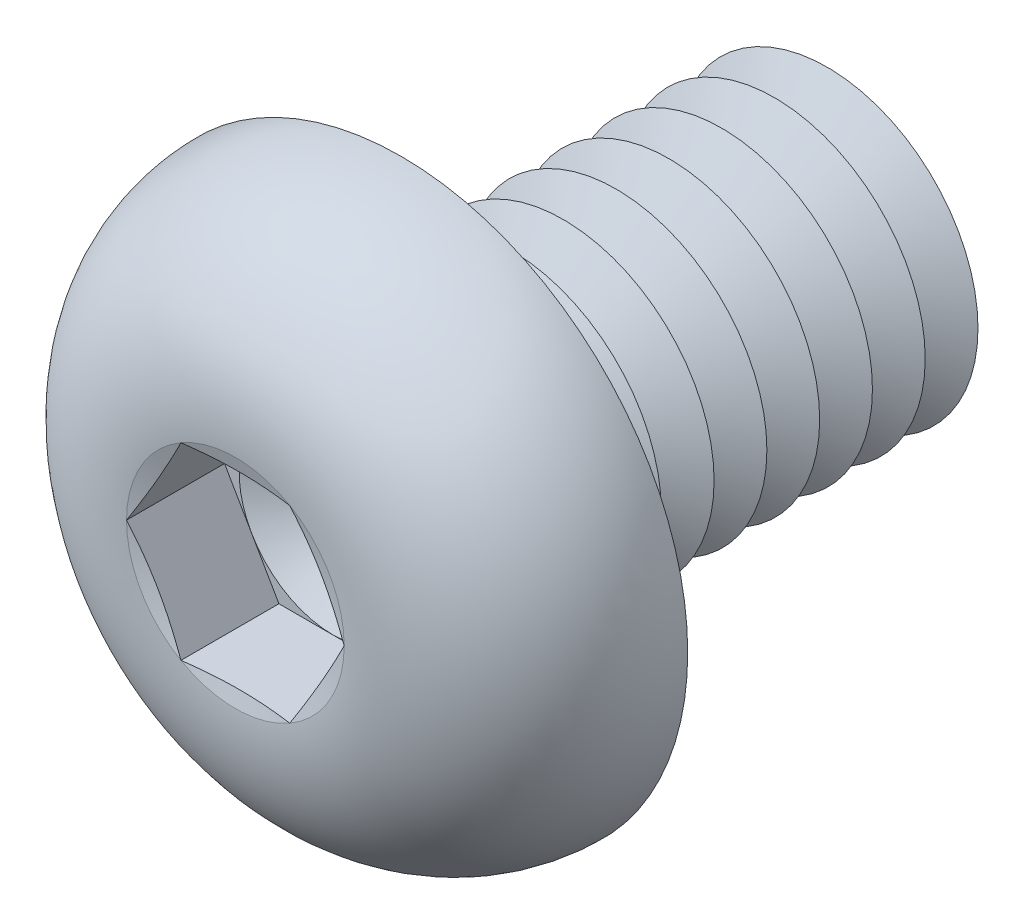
SolidWorks part; units mm, degrees
ref_plane "Front Plane" through (0, 0, 0) normal (0, 0, 1) x (1, 0, 0)
ref_plane "Top Plane" through (0, 0, 0) normal (0, 1, 0) x (1, 0, 0)
ref_plane "Right Plane" through (0, 0, 0) normal (1, 0, 0) x (0, 0, -1)
sketch "Sketch1" plane through (0, 0, 0) normal (1, 0, 0) x (0, 0, -1)
  line L0 (0, 2) -> (0, 3.8)
  line L3 (0, 2) -> (6, 2)
  line L4 (6, 2) -> (6, 0)
  line L5 (6, 0) -> (-2.2, 0) construction
  line L6 (-2.2, 0) -> (6, 0)
  line L7 (-2.2, 1.4434) -> (-2.2, 0.7217) construction
  line L8 (-2.2, 0.7217) -> (-2.2, 0)
  line L9 (-2.2, 1.4434) -> (-2.0066, 0.7217)
  line L10 (-2.0066, 0.7217) -> (-2.2, 0.7217)
  line L11 (6, 0) -> (22.7481, 0) construction
  line L12 (0, 3.8) -> (-2.2, 3.8) construction
  arc A1 (0, 3.8) -> (-2.2, 1.4434) centre (0, 1.5948) ccw
  point P8 (6, 1)
  dimension "D1" = 7.6
  dimension "D2" = 4
  dimension "D3" = 2.2
  dimension "D4" = 2.8868
  dimension "D5" = 6
  dimension "D6" = 15
revolve "Revolve1" add sketch "Sketch1" angle 360 about L5
fillet "Fillet1" radius 0.35 1 edges at (-2, 0, 0)
sketch "Sketch2" plane through (0, 0, 0) normal (1, 0, 0) x (0, 0, -1)
  line L0 (5.65, 2) -> (6.35, 2)
  line L1 (6, 2) -> (0.35, 2) construction
  line L2 (6.35, 2) -> (6, 1.3938)
  line L3 (6, -2) -> (6, 2) construction
  line L4 (6, 1.3938) -> (5.65, 2)
  dimension "D1" = 0.7
revolve "Cut-Revolve1" cut sketch "Sketch2" angle 360 about axis through (0, 0, -6) along (0, 0, -1)
pattern_linear "LPattern1" count 8 spacing 0.7 along (0, 0, 1) of "Cut-Revolve1"
sketch "Sketch3" plane through (0, 0, 2.2) normal (0, 0, 1) x (1, 0, 0)
  line L7 (0.7217, 1.25) -> (-0.7217, 1.25)
  line L8 (-0.7217, 1.25) -> (-1.4434, 0)
  line L9 (-1.4434, 0) -> (-0.7217, -1.25)
  line L10 (-0.7217, -1.25) -> (0.7217, -1.25)
  line L11 (0.7217, -1.25) -> (1.4434, 0)
  line L12 (1.4434, 0) -> (0.7217, 1.25)
  circle A0 centre (0, 0) radius 1.25 construction
  circle A3 centre (0, 0) radius 1.4434 construction
extrude "Cut-Extrude1" cut sketch "Sketch3" against normal blind 1.3
sketch "Sketch4" plane through (0, 0, 0.9) normal (0, 0, 1) x (1, 0, 0)
  line L1 (0.7217, 1.25) -> (-0.7217, 1.25) construction
  circle A0 centre (0, 0) radius 1.25
extrude "Cut-Extrude2" cut sketch "Sketch4" against normal through all draft 60
